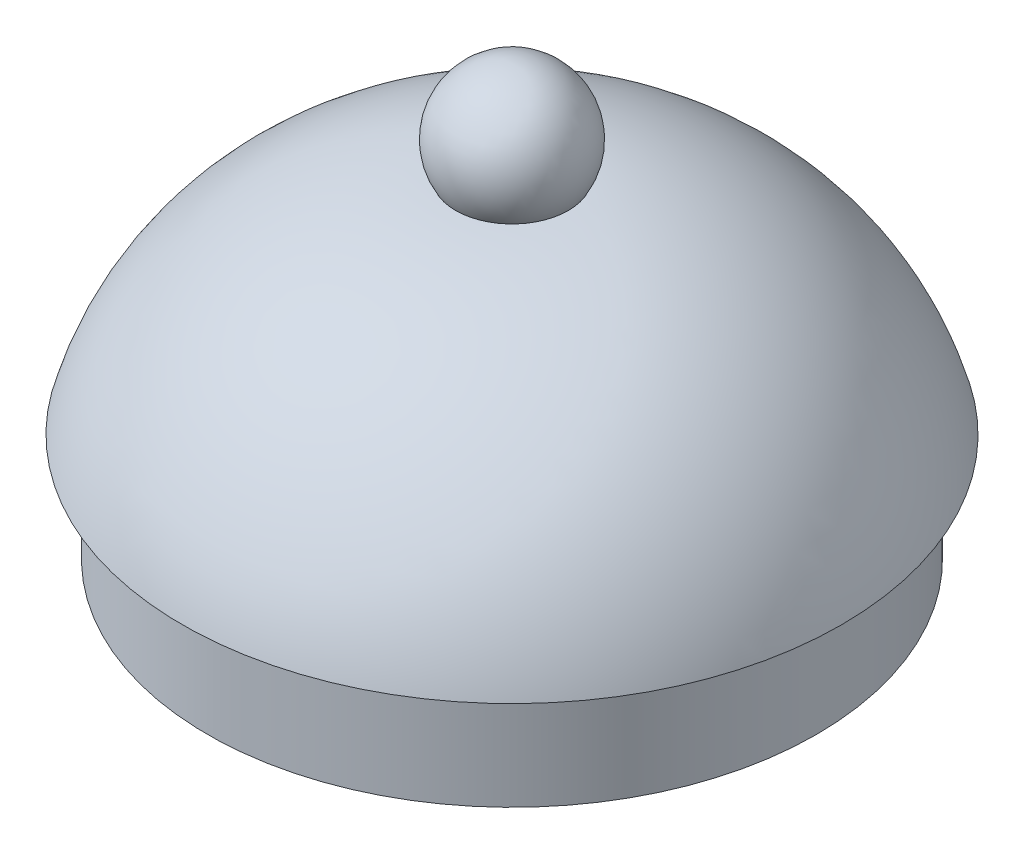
SolidWorks part; units mm, degrees
ref_plane "Спереди" through (0, 0, 0) normal (0, 0, 1) x (1, 0, 0)
ref_plane "Сверху" through (0, 0, 0) normal (0, 1, 0) x (1, 0, 0)
ref_plane "Справа" through (0, 0, 0) normal (1, 0, 0) x (0, 0, -1)
sketch "Эскиз1" plane through (0, 0, 0) normal (0, 0, 1) x (1, 0, 0)
  line L0 (0, 0) -> (243.4498, 0)
  line L1 (0, 261.9407) -> (0, 0)
  line L2 (243.4498, 0) -> (243.4498, 86)
  line L3 (263.5098, 86) -> (243.4498, 86)
  arc A0 (0, 261.9407) -> (263.5098, 86) centre (31.6467, 24.0363) cw
  dimension "D1" = 240
  dimension "D2" = 20.06
  dimension "D3" = 243.4498
  dimension "D4" = 86
  dimension "D5" = 261.9407
revolve "Повернуть2" add sketch "Эскиз1" angle 360 about L1
sketch "Эскиз2" plane through (0, 0, 0) normal (0, 0, 1) x (1, 0, 0)
  line L0 (0, 263.6606) -> (0, 342.8258)
  line L2 (0, 263.6606) -> (45.0708, 263.6606)
  arc A0 (263.5098, 86) -> (31.6467, 264.0363) centre (31.6467, 24.0363) ccw construction
  arc A1 (45.0708, 263.6606) -> (0, 342.8258) centre (0, 290.4132) ccw
  dimension "D1" = 52.4126
  dimension "D2" = 45.0708
revolve "Повернуть3" add sketch "Эскиз2" angle 360 about L0
